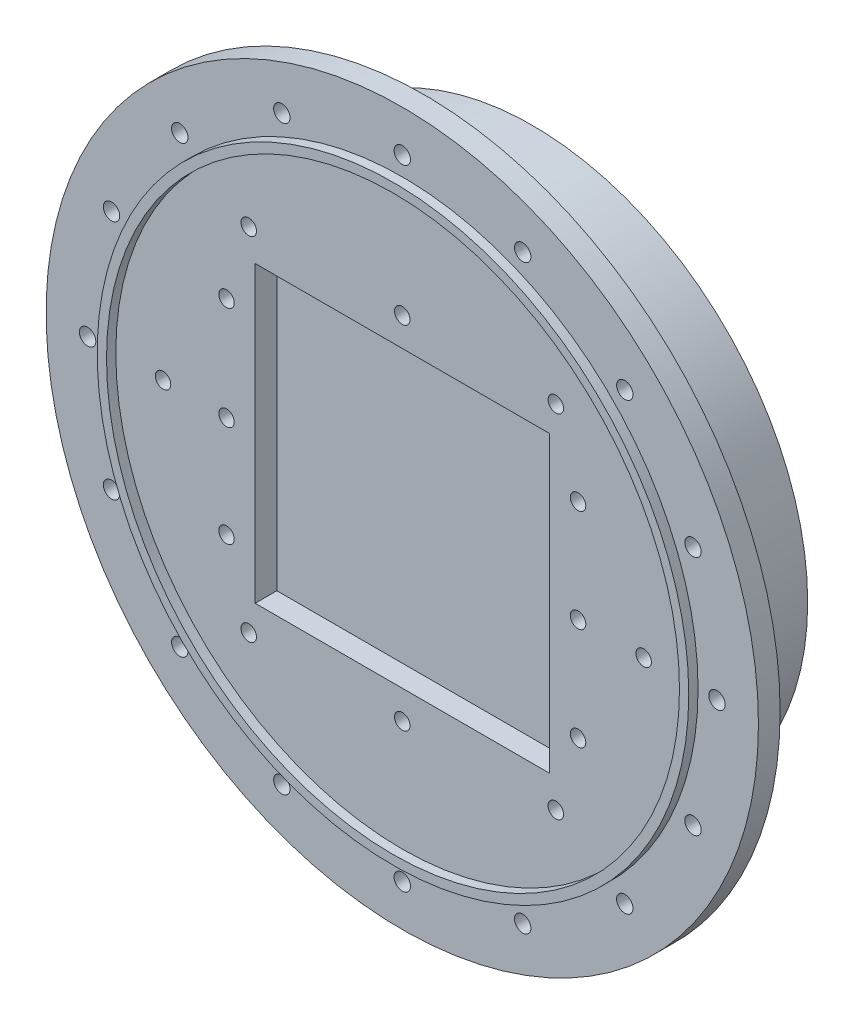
SolidWorks part; units mm, degrees
ref_plane "Front Plane" through (0, 0, 0) normal (0, 0, 1) x (1, 0, 0)
ref_plane "Top Plane" through (0, 0, 0) normal (0, 1, 0) x (1, 0, 0)
ref_plane "Right Plane" through (0, 0, 0) normal (1, 0, 0) x (0, 0, -1)
sketch "Sketch1" plane through (0, 0, 0) normal (0, 0, 1) x (1, 0, 0)
  line L0 (0, 120.8913) -> (0, -124.8631) construction
  line L1 (-124.62, 0) -> (119.8933, 0) construction
  line L3 (-47.5, 47.5) -> (47.5, 47.5)
  line L4 (-47.5, 47.5) -> (-47.5, -47.5)
  line L5 (-47.5, -47.5) -> (47.5, -47.5)
  line L6 (47.5, 47.5) -> (47.5, -47.5)
  circle A0 centre (0, 0) radius 115
  dimension "D1" = 230
  dimension "D2" = 95
  dimension "D3" = 95
extrude "Boss-Extrude1" add sketch "Sketch1" along normal blind 7
sketch "Sketch2" plane through (0, 0, 7) normal (0, 0, 1) x (1, 0, 0)
  circle A0 centre (0, 0) radius 95.5
  circle A1 centre (0, 0) radius 94 construction
  circle A2 centre (0, 0) radius 92.5
  dimension "D1" = 1.5
  dimension "D2" = 1.5
  dimension "D3" = 188
extrude "Boss-Extrude2" add sketch "Sketch2" along normal blind 3
sketch "Sketch3" plane through (0, 0, 7) normal (0, 0, 1) x (1, 0, 0)
  line L0 (-131.4626, 56.7499) -> (152.7953, 56.7499) construction
  line L1 (56.7499, 114.2399) -> (56.75, -119.1383) construction
  line L2 (-117.3375, -56.7499) -> (123.7805, -56.7499) construction
  line L3 (-56.7499, 109.7793) -> (-56.7499, -113.7938) construction
  line L4 (-131.4626, 0) -> (133.4451, 0) construction
  line L5 (0, 120.4351) -> (0, -120.6829)
  line L6 (77.2503, 109.7793) -> (77.2503, -110.3153) construction
  line L7 (-77.2503, 101.3538) -> (-77.2503, -110.2749) construction
  line L8 (-16.5252, 117.7092) -> (-16.5252, -122.6654) construction
  line L9 (16.5252, 117.7092) -> (16.5252, -120.6829) construction
  line L10 (49.5757, 114.2399) -> (49.5757, -120.752)
  line L11 (-49.5757, 114.2399) -> (-49.5757, -119.1383)
  line L12 (-115.355, 33.0505) -> (126.5064, 33.0505) construction
  line L13 (-115.355, -33.0505) -> (117.5853, -33.0505) construction
  circle A0 centre (0, 0) radius 101.6
  dimension "D13" = 203.2
  dimension "D1" = 56.7499
  dimension "D2" = 56.7499
  dimension "D3" = 56.7499
  dimension "D4" = 56.7499
  dimension "D5" = 77.2503
  dimension "D6" = 77.2503
  dimension "D7" = 33.0505
  dimension "D8" = 16.5252
  dimension "D9" = 33.0505
  dimension "D10" = 33.0505
  dimension "D11" = 33.0505
  dimension "D12" = 33.0505
hole_wizard "M6x1.0 Tapped Hole4" positions "3DSketch4" profile "Sketch7" tap size "M6x1.0" standard "Ansi Metric"
sketch3d "3DSketch4"
  line L0 (-49.5757, 114.2399, 7) -> (-49.5757, -119.1383, 7) construction
  line L1 (-131.4626, 56.7499, 7) -> (152.7953, 56.7499, 7) construction
  line L2 (0, 120.4351, 7) -> (0, -120.6829, 7) construction
  line L3 (49.5757, 114.2399, 7) -> (49.5757, -120.752, 7) construction
  line L4 (-117.3375, -56.7499, 7) -> (123.7805, -56.7499, 7) construction
  line L5 (-77.2503, 101.3538, 7) -> (-77.2503, -110.2749, 7) construction
  line L6 (-131.4626, 0, 7) -> (133.4451, 0, 7) construction
  line L7 (77.2503, 109.7793, 7) -> (77.2503, -110.3153, 7) construction
  line L8 (-56.7499, 109.7793, 7) -> (-56.7499, -113.7938, 7) construction
  line L9 (-115.355, 33.0505, 7) -> (126.5064, 33.0505, 7) construction
  line L10 (56.7499, 114.2399, 7) -> (56.75, -119.1383, 7) construction
  line L11 (-115.355, -33.0505, 7) -> (117.5853, -33.0505, 7) construction
  point P0 (-49.5757, 56.7499, 7)
  point P6 (0, 56.7499, 7)
  point P10 (49.5757, 56.7499, 7)
  point P14 (49.5757, -56.7499, 7)
  point P18 (0, -56.7499, 7)
  point P20 (-49.5757, -56.7499, 7)
  point P22 (-77.2503, 0, 7)
  point P28 (77.2503, -0.268, 7)
  point P33 (-56.7499, -0.2478, 7)
  point P37 (-56.7499, 33.0505, 7)
  point P41 (-56.7499, -32.9586, 7)
  point P43 (56.7499, 33.0505, 7)
  point P47 (56.7499, 0, 7)
  point P49 (56.7499, -33.0505, 7)
sketch "Sketch7" plane through (-49.5757, 56.7499, 7) normal (1, 0, 0) x (0, -1, 0)
  line L0 (0, 0) -> (0, 18.5202)
  line L1 (0, 18.5202) -> (2.5, 17.018)
  line L2 (2.5, 17.018) -> (2.5, 0)
  line L5 (2.5, 0) -> (0, 0)
  line L10 (0, 18.5202) -> (-2.5, 17.018) construction
  line L11 (0, -6.35) -> (0, 107.95) construction
  dimension "Tap Drill Dia." = 5
  dimension "Tap Drill Depth" = 17.018
  dimension "Drill Angle" = 118
hole_wizard "M6x1.0 Tapped Hole5" positions "3DSketch5" profile "Sketch8" tap size "M6x1.0" standard "Ansi Metric"
sketch3d "3DSketch5"
  line L0 (-131.4626, 0, 7) -> (133.4451, 0, 7) construction
  point P0 (77.9359, 0, 7)
sketch "Sketch8" plane through (77.9359, 0, 7) normal (1, 0, 0) x (0, -1, 0)
  line L0 (0, 0) -> (0, 18.5202)
  line L1 (0, 18.5202) -> (2.5, 17.018)
  line L2 (2.5, 17.018) -> (2.5, 0)
  line L5 (2.5, 0) -> (0, 0)
  line L10 (0, 18.5202) -> (-2.5, 17.018) construction
  line L11 (0, -6.35) -> (0, 107.95) construction
  dimension "Tap Drill Dia." = 5
  dimension "Tap Drill Depth" = 17.018
  dimension "Drill Angle" = 118
sketch "Sketch9" plane through (0, 0, 7) normal (0, 0, 1) x (1, 0, 0)
  line L0 (0, 120.4351) -> (0, -120.6829) construction
  circle A0 centre (0, 101.6) radius 2.1527
  circle A1 centre (0, 0) radius 101.6 construction
  dimension "D1" = 4.3053
extrude "Cut-Extrude1" [suppressed] cut sketch "Sketch9" against normal up to surface (7 mm away)
pattern_circular "CirPattern1" [suppressed] count 24 every 15
sketch "Sketch10" plane through (0, 0, 0) normal (0, 0, -1) x (-1, 0, 0)
  circle A0 centre (0, 0) radius 88.9
  dimension "D1" = 177.8
extrude "Boss-Extrude3" add sketch "Sketch10" along normal blind 35
hole_wizard "M5 Clearance Hole1" positions "3DSketch6" profile "Sketch11" hole size "M5" standard "Ansi Metric"
sketch3d "3DSketch6"
  point P0 (0, 101.6, 7)
sketch "Sketch11" plane through (0, 101.6, 7) normal (1, 0, 0) x (0, -1, 0)
  line L0 (0, 0) -> (0, 26.9923)
  line L1 (0, 26.9923) -> (2.65, 25.4)
  line L2 (2.65, 25.4) -> (2.65, 0)
  line L5 (2.65, 0) -> (0, 0)
  line L10 (0, 26.9923) -> (-2.65, 25.4) construction
  line L11 (0, -6.35) -> (0, 107.95) construction
  dimension "Hole Dia." = 5.3
  dimension "Hole Depth" = 25.4
  dimension "Drill Angle" = 118
pattern_circular "CirPattern2" count 16 over 360 about axis through (0, 0, 0) along (0, 0, 1) of "M5 Clearance Hole1"
